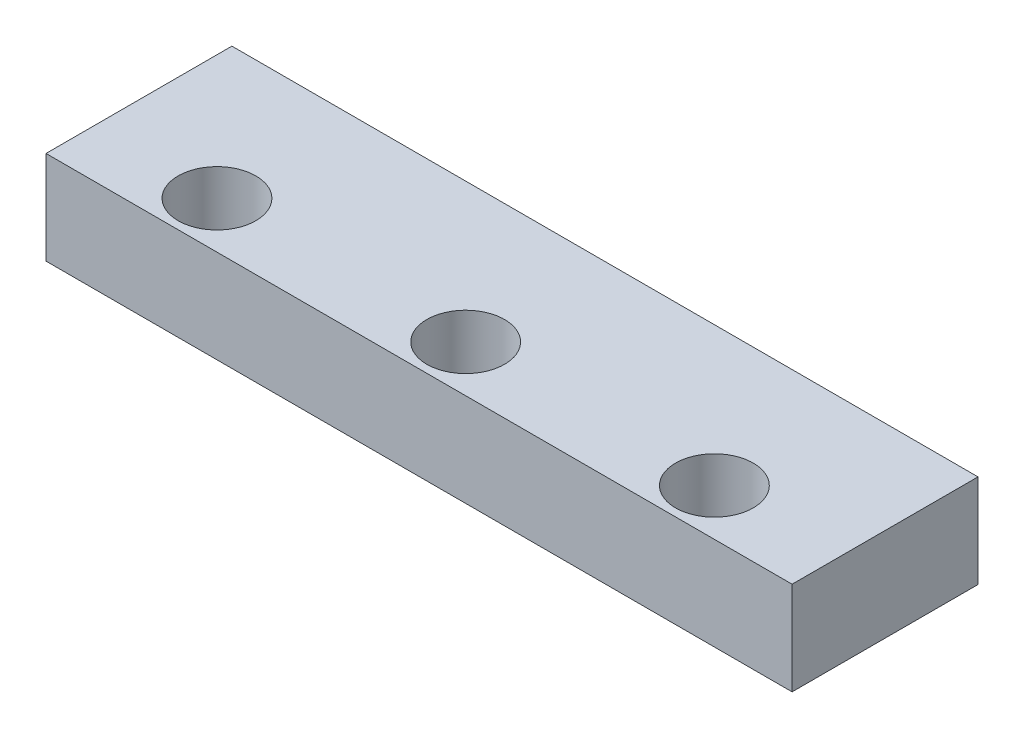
SolidWorks part; units mm, degrees
ref_plane "Front Plane" through (0, 0, 0) normal (0, 0, 1) x (1, 0, 0)
ref_plane "Top Plane" through (0, 0, 0) normal (0, 1, 0) x (1, 0, 0)
ref_plane "Right Plane" through (0, 0, 0) normal (1, 0, 0) x (0, 0, -1)
sketch "Sketch1" plane through (0, 0, 0) normal (0, 0, 1) x (1, 0, 0)
  line L1 (0, 0) -> (120, 0)
  line L2 (0, 0) -> (0, -15)
  line L3 (0, -15) -> (120, -15)
  line L4 (120, 0) -> (120, -15)
  dimension "D1" = 120
  dimension "D2" = 15
extrude "Boss-Extrude1" add sketch "Sketch1" along normal blind 30
sketch "Sketch3" plane through (0, 0, 0) normal (0, 1, 0) x (1, 0, 0)
  line L0 (0, -30) -> (0, -15)
  line L1 (0, -30) -> (0, 0) construction
  line L2 (0, -15) -> (0, -22.5)
  circle A0 centre (60, -22.5) radius 6.25
  circle A1 centre (20, -22.5) radius 6.25
  circle A2 centre (100, -22.5) radius 6.25
  dimension "D1" = 12.5
  dimension "D2" = 12.5
  dimension "D3" = 12.5
  dimension "D4" = 40
  dimension "D5" = 40
extrude "Cut-Extrude1" cut sketch "Sketch3" against normal blind 10 contours A1 | A0 | A2
sketch "Sketch4" plane through (0, -10, 0) normal (0, 1, 0) x (1, 0, 0)
  circle A0 centre (20, -22.5) radius 4
  circle A1 centre (60, -22.5) radius 4
  circle A2 centre (100, -22.5) radius 4
  dimension "D1" = 8
extrude "Cut-Extrude2" cut sketch "Sketch4" against normal blind 10
sketch "Sketch5" plane through (0, 0, 0) normal (-1, 0, 0) x (0, 0, 1)
  line L1 (0, 0) -> (0.1, 0)
  line L2 (0, 0) -> (0, -17.3898)
  line L3 (0, -17.3898) -> (0.1, -17.3898)
  line L4 (0.1, 0) -> (0.1, -17.3898)
  dimension "D1" = 0.1
extrude "Cut-Extrude3" cut sketch "Sketch5" against normal blind 133
